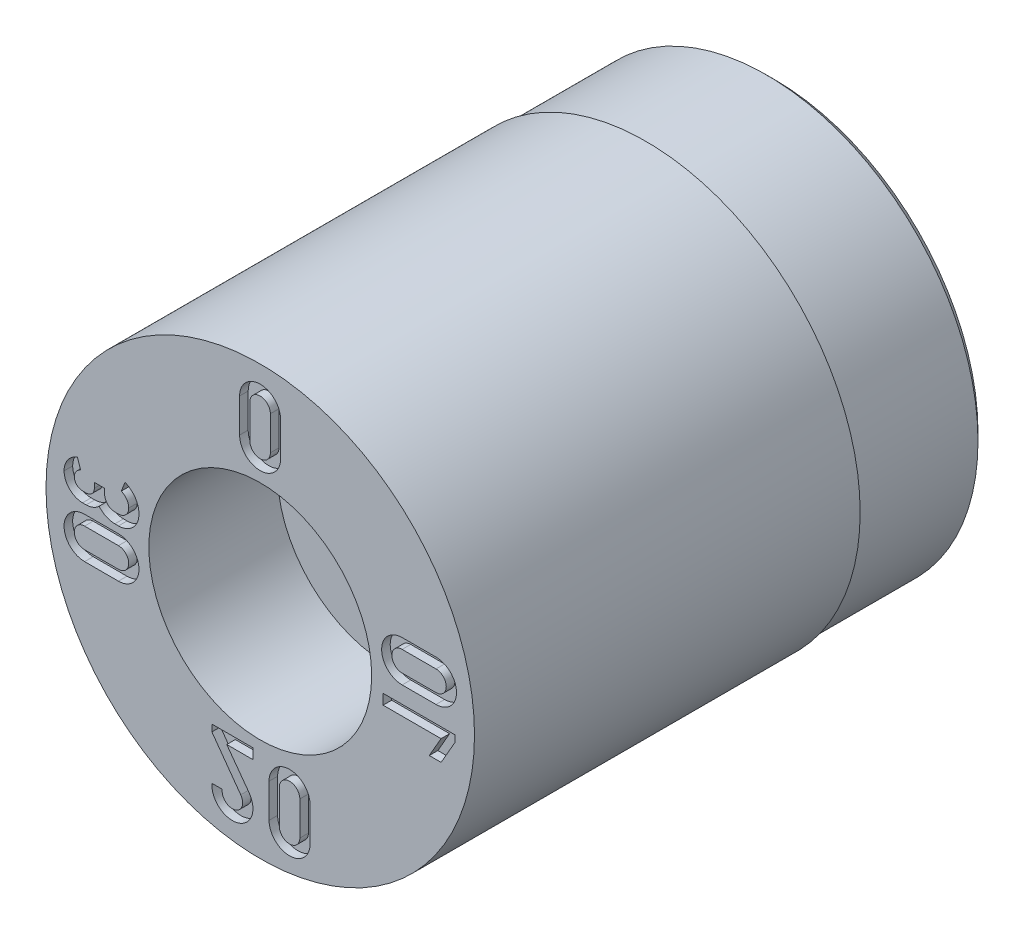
SolidWorks part; units mm, degrees
ref_plane "Front Plane" through (0, 0, 0) normal (0, 0, 1) x (1, 0, 0)
ref_plane "Top Plane" through (0, 0, 0) normal (0, 1, 0) x (1, 0, 0)
ref_plane "Right Plane" through (0, 0, 0) normal (1, 0, 0) x (0, 0, -1)
sketch "Sketch1" plane through (0, 0, 0) normal (1, 0, 0) x (0, 0, -1)
  line L2 (0, 5) -> (0, 2.6)
  line L3 (11.75, 5) -> (0, 5)
  line L4 (-3.7979, 0) -> (49996.2021, 0) construction
  line L8 (12, 1.25) -> (3, 1.25)
  line L9 (3, 2.6) -> (3, 1.25)
  line L10 (3, 2.6) -> (0, 2.6)
  line L12 (12, 1.25) -> (12, 4.75)
  line L16 (12, 4.75) -> (11.75, 5)
  dimension "D1" = 12
  dimension "D2" = 45
  dimension "D3" = 0.25
  dimension "D4" = 10
  dimension "D5" = 5.2
  dimension "D6" = 3
  dimension "D7" = 2.5
revolve "Revolve1" add sketch "Sketch1" angle 360 about L4
sketch "Sketch4" plane through (0, 0, 0) normal (1, 0, 0) x (0, 0, -1)
  line L0 (0, 0) -> (50000, 0) construction
  line L1 (12, -4.75) -> (12, 4.75) construction
  line L2 (9, 5.935) -> (12, 5.935)
  line L3 (9, 5.935) -> (9, 4.935)
  line L4 (9, 4.935) -> (12, 4.935)
  line L5 (12, 5.935) -> (12, 4.935)
  line L6 (11.75, 5) -> (0, 5) construction
  line L9 (0, 5.5) -> (0, -5.5) construction
  dimension "D1" = 1
  dimension "D2" = 0.065
  dimension "D3" = 9
revolve "Cut-Revolve1" cut sketch "Sketch4" angle 360 about L0
sketch "Sketch2" plane through (0, 0, 0) normal (0, 0, 1) x (1, 0, 0)
  line L690 (0.4448, -3.3304) -> (0.4449, -4.1203)
  line L691 (0.9236, -4.1203) -> (0.9236, -3.3304)
  line L692 (1.163, -4.1203) -> (1.1631, -3.3304)
  line L693 (0.2054, -3.3305) -> (0.2055, -4.1203)
  line L694 (-3.3089, 0.3123) -> (-3.3927, 0.3123)
  line L695 (-3.632, 0.5516) -> (-3.632, 0.6713)
  line L696 (-3.632, 0.6713) -> (-3.8714, 0.6713)
  line L697 (-3.8714, 0.6713) -> (-3.8714, 0.5517)
  line L698 (-4.0629, 0.3602) -> (-4.1466, 0.3602)
  line L699 (-4.1916, 0.7558) -> (-4.2682, 0.9826)
  line L700 (-4.1466, 0.1208) -> (-4.0629, 0.1208)
  line L701 (-3.3927, 0.0729) -> (-3.3089, 0.0729)
  line L702 (-3.156, 1.0303) -> (-3.2438, 0.8077)
  line L703 (4.1014, 1.1265) -> (3.3115, 1.1265)
  line L704 (3.3116, 0.1689) -> (4.1015, 0.169)
  line L705 (3.3116, 0.4083) -> (4.1014, 0.4084)
  line L706 (4.1014, 0.8871) -> (3.3115, 0.8871)
  line L707 (4.5426, -0.2233) -> (4.5426, -0.3809)
  line L708 (4.5426, -0.3809) -> (4.2204, -0.9414)
  line L709 (4.2204, -0.9414) -> (3.9443, -0.9414)
  line L710 (3.9443, -0.9414) -> (4.2194, -0.4627)
  line L711 (4.2194, -0.4627) -> (2.8671, -0.4628)
  line L712 (2.8671, -0.4628) -> (2.8671, -0.2235)
  line L713 (2.8671, -0.2235) -> (4.5426, -0.2233)
  line L714 (-0.1713, -3.0817) -> (-0.1714, -2.8423)
  line L715 (-0.1714, -2.8423) -> (-1.1288, -2.8424)
  line L716 (-1.1288, -2.8424) -> (-1.1288, -3.0007)
  line L717 (-1.1288, -3.0007) -> (-0.4556, -3.9351)
  line L718 (-0.8866, -4.0391) -> (-1.1273, -4.0391)
  line L719 (-0.2611, -3.7949) -> (-0.7817, -3.0817)
  line L720 (-0.7817, -3.0817) -> (-0.1713, -3.0817)
  line L721 (-0.4816, 4.1122) -> (-0.4815, 3.3223)
  line L722 (0.4759, 3.3223) -> (0.476, 4.1122)
  line L723 (0.2366, 3.3223) -> (0.2365, 4.1122)
  line L724 (-0.2421, 4.1122) -> (-0.2422, 3.3223)
  line L725 (-3.3096, -0.8052) -> (-4.0994, -0.805)
  line L726 (-4.0994, -0.3263) -> (-3.3095, -0.3263)
  line L727 (-4.0994, -0.0869) -> (-3.3095, -0.0869)
  line L728 (-3.3096, -1.0445) -> (-4.0995, -1.0444)
  arc A324 (0.9236, -3.3304) -> (0.4448, -3.3304) centre (0.6842, -3.3304) ccw
  arc A325 (0.4449, -4.1203) -> (0.9236, -4.1203) centre (0.6842, -4.1203) ccw
  arc A326 (1.1631, -3.3304) -> (0.2054, -3.3305) centre (0.6842, -3.3304) ccw
  arc A327 (0.2055, -4.1203) -> (1.163, -4.1203) centre (0.6842, -4.1203) ccw
  arc A328 (-3.0696, 0.5516) -> (-3.2438, 0.8077) centre (-3.3449, 0.5517) ccw
  arc A329 (-3.3089, 0.3123) -> (-3.0696, 0.5516) centre (-3.3089, 0.5517) ccw
  arc A330 (-3.632, 0.5516) -> (-3.3927, 0.3123) centre (-3.3927, 0.5516) ccw
  arc A331 (-4.0629, 0.3602) -> (-3.8714, 0.5517) centre (-4.0628, 0.5517) ccw
  arc A332 (-4.3381, 0.5517) -> (-4.1466, 0.3602) centre (-4.1464, 0.5519) ccw
  arc A333 (-4.1916, 0.7558) -> (-4.3381, 0.5517) centre (-4.123, 0.5519) ccw
  arc A334 (-4.2682, 0.9826) -> (-4.5775, 0.5518) centre (-4.1226, 0.5516) ccw
  arc A335 (-4.5775, 0.5518) -> (-4.1466, 0.1208) centre (-4.1467, 0.5516) ccw
  arc A336 (-4.0629, 0.1208) -> (-3.7603, 0.245) centre (-4.0628, 0.5515) ccw
  arc A337 (-3.7603, 0.245) -> (-3.3927, 0.0729) centre (-3.3928, 0.5514) ccw
  arc A338 (-3.3089, 0.0729) -> (-2.8302, 0.5516) centre (-3.3089, 0.5515) ccw
  arc A339 (-2.8302, 0.5516) -> (-3.156, 1.0303) centre (-3.345, 0.5515) ccw
  arc A340 (3.3115, 1.1265) -> (3.3116, 0.1689) centre (3.3116, 0.6477) ccw
  arc A341 (4.1015, 0.169) -> (4.1014, 1.1265) centre (4.1014, 0.6477) ccw
  arc A342 (3.3115, 0.8871) -> (3.3116, 0.4083) centre (3.3116, 0.6477) ccw
  arc A343 (4.1014, 0.4084) -> (4.1014, 0.8871) centre (4.1014, 0.6477) ccw
  arc A344 (-0.8866, -4.0391) -> (-0.4556, -3.9351) centre (-0.6499, -4.075) ccw
  arc A345 (-1.1273, -4.0391) -> (-0.2611, -3.7949) centre (-0.6498, -4.0747) ccw
  arc A346 (-0.4815, 3.3223) -> (0.4759, 3.3223) centre (-0.0028, 3.3223) ccw
  arc A347 (0.476, 4.1122) -> (-0.4816, 4.1122) centre (-0.0028, 4.1122) ccw
  arc A348 (-0.2422, 3.3223) -> (0.2366, 3.3223) centre (-0.0028, 3.3223) ccw
  arc A349 (0.2365, 4.1122) -> (-0.2421, 4.1122) centre (-0.0028, 4.1122) ccw
  arc A350 (-3.3096, -0.8052) -> (-3.3095, -0.3263) centre (-3.3095, -0.5657) ccw
  arc A351 (-4.0994, -0.3263) -> (-4.0994, -0.805) centre (-4.0994, -0.5657) ccw
  arc A352 (-3.3096, -1.0445) -> (-3.3095, -0.0869) centre (-3.3095, -0.5657) ccw
  arc A353 (-4.0994, -0.0869) -> (-4.0995, -1.0444) centre (-4.0994, -0.5657) ccw
  point P1334 (0, 0.0077)
  point P1335 (0.0077, 0.0077)
  point P1336 (0.0077, 0)
extrude "Cut-Extrude1" cut sketch "Sketch2" against normal blind 0.2
